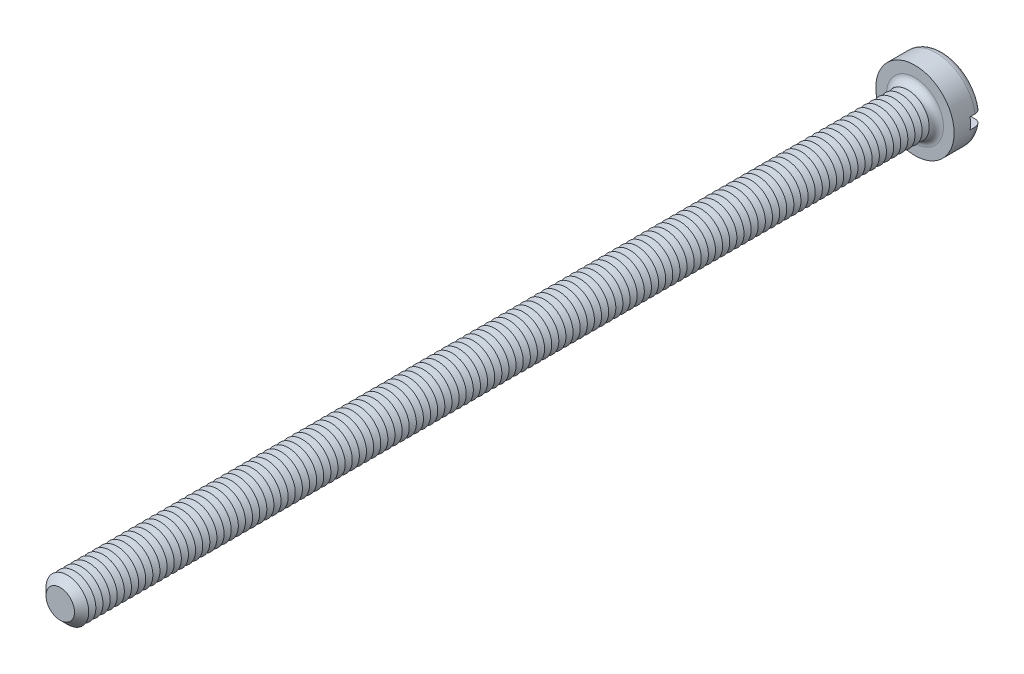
SolidWorks part; units mm, degrees
ref_plane "Front Plane" through (0, 0, 0) normal (0, 0, 1) x (1, 0, 0)
ref_plane "Top Plane" through (0, 0, 0) normal (0, 1, 0) x (1, 0, 0)
ref_plane "Right Plane" through (0, 0, 0) normal (1, 0, 0) x (0, 0, -1)
sketch "Sketch3" plane through (0, 0, 0) normal (0, 0, 1) x (1, 0, 0)
  circle A0 centre (0, 0) radius 2.75
  dimension "D1" = 5.5
extrude "Boss-Extrude2" add sketch "Sketch3" against normal blind 2
sketch "Sketch4" plane through (0, 0, 0) normal (0, 0, 1) x (1, 0, 0)
  circle A0 centre (0, 0) radius 1.5
  dimension "D1" = 3
extrude "Boss-Extrude3" add sketch "Sketch4" along normal blind 60
fillet "Fillet1" radius 0.5 2 edges at (2.75, 0, -2) (1.5, 0, 0)
chamfer "Chamfer1" distance 0.5 angle 45 1 edges at (1.5, 0, 60)
sketch "Sketch5" plane through (0, 0, 0) normal (1, 0, 0) x (0, 0, -1)
  line L0 (1.6944, 0) -> (-7.6738, 0) construction
sketch "Sketch6" plane through (0, 0, 0) normal (1, 0, 0) x (0, 0, -1)
  line L0 (-0.5, 1.5) -> (-0.75, 1.067)
  line L1 (-0.75, 1.067) -> (-1, 1.5)
  line L2 (-0.5, 1.5) -> (-59.5, 1.5) construction
  line L3 (-1, 1.5) -> (-0.5, 1.5)
  dimension "D1" = 0.5
revolve "Cut-Revolve1" cut sketch "Sketch6" angle 360 about L0
pattern_linear "LPattern1" count 118 spacing 0.5 along (0, 0, 1) of "Cut-Revolve1"
sketch "Sketch8" plane through (0, 0, -2) normal (0, 0, -1) x (-1, 0, 0)
  line L1 (2.75, -0.4) -> (-2.75, -0.4)
  line L2 (2.75, -0.4) -> (2.75, 0.4)
  line L3 (2.75, 0.4) -> (-2.75, 0.4)
  line L4 (-2.75, -0.4) -> (-2.75, 0.4)
  line L5 (2.75, -0.4) -> (-2.75, 0.4) construction
  line L6 (2.75, 0.4) -> (-2.75, -0.4) construction
  point P0 (0, 0)
  dimension "D1" = 5.5
  dimension "D2" = 0.8
extrude "Cut-Extrude1" cut sketch "Sketch8" against normal blind 0.85
